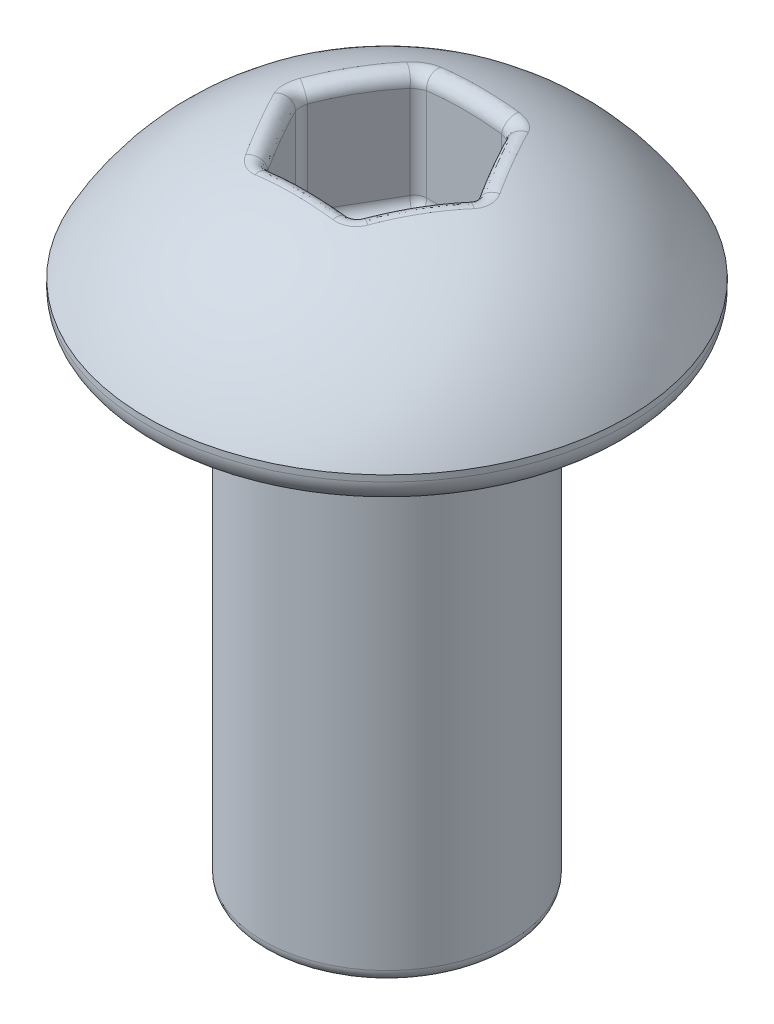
SolidWorks part; units mm, degrees
ref_plane "Front" through (0, 0, 0) normal (0, 0, 1) x (1, 0, 0)
ref_plane "Top" through (0, 0, 0) normal (0, 1, 0) x (1, 0, 0)
ref_plane "Right" through (0, 0, 0) normal (1, 0, 0) x (0, 0, -1)
sketch "草图1" plane through (0, 0, 0) normal (0, 1, 0) x (1, 0, 0)
  circle A0 centre (0, 0) radius 2
  dimension "螺丝直径" = 4
extrude "凸台-拉伸1" add sketch "草图1" against normal blind 8
sketch "草图2" plane through (0, 0, 0) normal (0, 0, 1) x (1, 0, 0)
  line L0 (0, -1000) -> (0, 49000) construction
  line L1 (-1000, 0) -> (49000, 0) construction
  line L2 (-3.9, 0) -> (3.9, 0) construction
  line L3 (-999.5875, 2.5) -> (49000.4125, 2.5) construction
  line L4 (-3.9, -1000) -> (-3.9, 49000) construction
  line L5 (3.9, -1000) -> (3.9, 49000) construction
  line L6 (-3.9, 0.5) -> (3.9, 0.5) construction
  line L7 (1.25, 2.5) -> (-1.25, 2.5)
  line L8 (-3.9, 0.5) -> (-3.9, 0.4)
  line L9 (-3.5, 0) -> (3.5, 0)
  line L10 (3.9, 0.4) -> (3.9, 0.5)
  line L11 (0, 2.5) -> (0, 0)
  arc A0 (3.5, 0) -> (3.9, 0.4) centre (3.5, 0.4) ccw
  arc A1 (-3.9, 0.4) -> (-3.5, 0) centre (-3.5, 0.4) ccw
  arc A2 (-3.9, 0.5) -> (-1.25, 2.5) centre (-0.3827, -1.4048) cw
  arc A3 (3.9, 0.5) -> (1.25, 2.5) centre (0.3827, -1.4048) ccw
  point P18 (0, 2.5)
  dimension "D2" = 0.4
  dimension "D3" = 4
  dimension "D1" = 0.5
  dimension "螺丝头半径" = 3.9
  dimension "螺丝头厚度" = 2.5
  dimension "六角直径" = 2.5
revolve "旋转1" add sketch "草图2" angle 360 about L0
sketch "草图3" plane through (0, 2.5, 0) normal (0, 1, 0) x (1, 0, 0)
  line L1 (1.4434, 0) -> (0.7217, 1.25)
  line L2 (0.7217, 1.25) -> (-0.7217, 1.25)
  line L3 (-0.7217, 1.25) -> (-1.4434, 0)
  line L4 (-1.4434, 0) -> (-0.7217, -1.25)
  line L5 (-0.7217, -1.25) -> (0.7217, -1.25)
  line L6 (0.7217, -1.25) -> (1.4434, 0)
  circle A0 centre (0, 0) radius 1.25 construction
  dimension "六角直径2" = 2.5
extrude "切除-拉伸1" cut sketch "草图3" against normal blind 2 and the other way through all contours L2 L3 L4 L5 L6 L1
fillet "圆角1" radius 0.2 19 edges at (1.0825, 0.5, -0.625) (-1.0825, 0.5, -0.625) (-1.4434, 1.476, 0) (-1.0825, 0.5, 0.625) (-0.7217, 1.476, 1.25) (0, 0.5, 1.25) (0.7217, 1.476, 1.25) (1.0825, 0.5, 0.625) (1.4434, 1.476, 0) (0.7217, 1.476, -1.25) (0, 0.5, -1.25) (-0.7217, 1.476, -1.25) (0, -8, 2)
other "冻结***"
equation "\"2。8\"=3"
